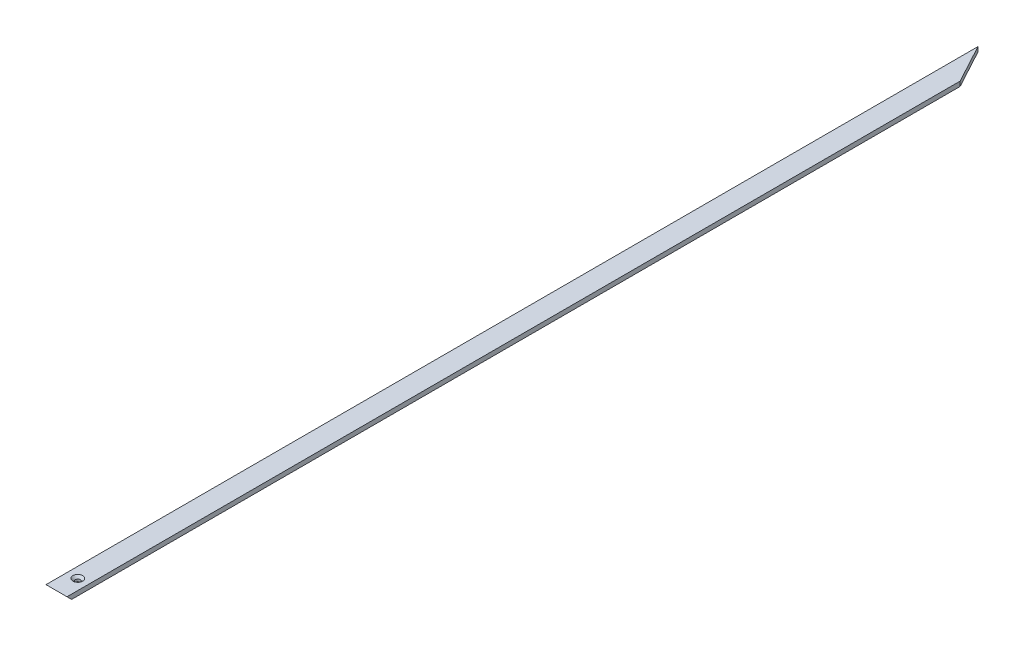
SolidWorks part; units mm, degrees
ref_plane "Plan de face" through (0, 0, 0) normal (0, 0, 1) x (1, 0, 0)
ref_plane "Plan de dessus" through (0, 0, 0) normal (0, 1, 0) x (1, 0, 0)
ref_plane "Plan de droite" through (0, 0, 0) normal (1, 0, 0) x (0, 0, -1)
sketch "Esquisse1" plane through (0, 0, 0) normal (0, 0, 1) x (1, 0, 0)
  line L1 (-13.5, 0) -> (13.5, 0)
  line L2 (-13.5, 0) -> (-13.5, 6)
  line L3 (-13.5, 6) -> (13.5, 6)
  line L4 (13.5, 0) -> (13.5, 6)
  point P4 (0, 0)
  dimension "D1" = 27
  dimension "D2" = 6
extrude "Extrusion1" add sketch "Esquisse1" along normal mid plane 1200
chamfer "Chanfrein1" distance 6 angle 45 1 edges at (0, 0, 600)
chamfer "Chanfrein2" distance 27 distance2 50 1 edges at (13.5, 3, -600)
hole_wizard "Fraisage pour vis à tête fraisée M61" positions "Esquisse3" profile "Esquisse2" countersink size "M6" standard "ISO"
sketch "Esquisse3" plane through (0, 6, 0) normal (0, 1, 0) x (-1, 0, 0)
  line L0 (-13.5, 600) -> (13.5, 600) construction
  line L1 (-13.5, 600) -> (-13.5, -550) construction
  point P0 (0, 572.5)
  dimension "D1" = 27.5
  dimension "D2" = 13.5
sketch "Esquisse2" plane through (0, 6, 572.5) normal (1, 0, 0) x (0, 0, 1)
  line L0 (0, 0) -> (0, 6)
  line L1 (0, 6) -> (3.25, 6)
  line L2 (3.25, 6) -> (3.25, 3.05)
  line L3 (3.25, 3.05) -> (6.3, 0)
  line L5 (6.3, 0) -> (0, 0)
  line L6 (-3.25, 3.05) -> (-6.3, 0) construction
  line L11 (0, -6.35) -> (0, 107.95) construction
  dimension "Diamètre du perçage jusqu'au prochain" = 6.5
  dimension "Profondeur du perçage jusqu'au prochain" = 6
  dimension "Diamètre du fraisage entrant" = 12.6
  dimension "Angle du fraisage entrant" = 90
